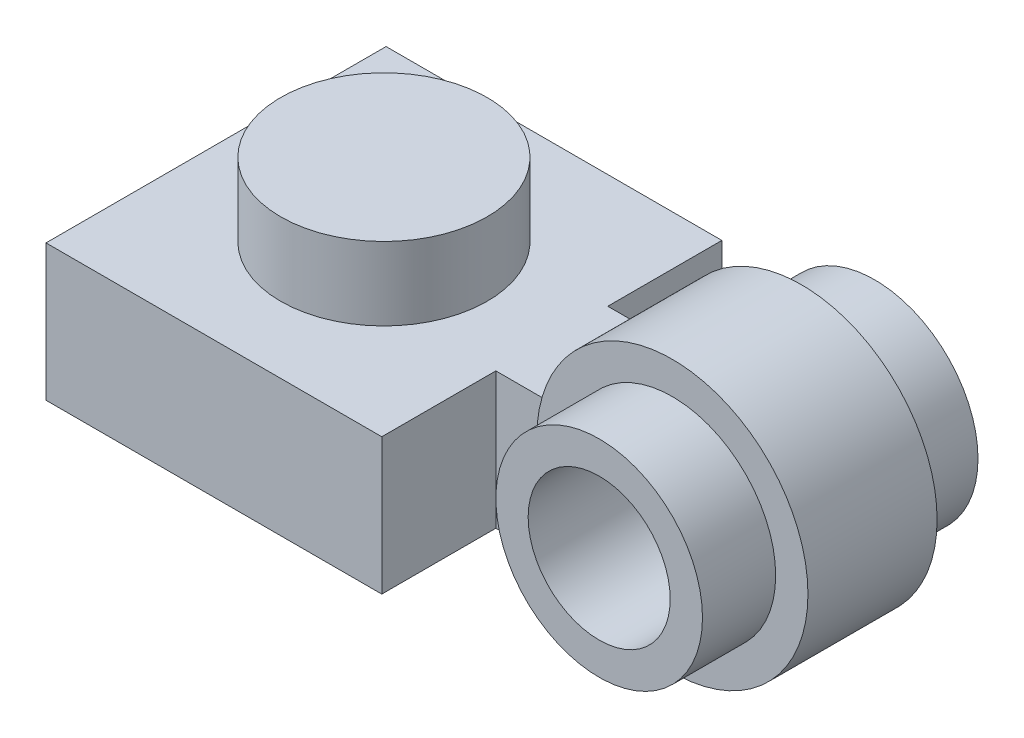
SolidWorks part; units mm, degrees
ref_plane "Front Plane" through (0, 0, 0) normal (0, 0, 1) x (1, 0, 0)
ref_plane "Top Plane" through (0, 0, 0) normal (0, 1, 0) x (1, 0, 0)
ref_plane "Right Plane" through (0, 0, 0) normal (1, 0, 0) x (0, 0, -1)
sketch "Sketch1" plane through (0, 0, 0) normal (0, 1, 0) x (1, 0, 0)
  line L1 (3.9, -3.95) -> (-3.9, -3.95)
  line L2 (3.9, -3.95) -> (3.9, 3.95)
  line L3 (3.9, 3.95) -> (-3.9, 3.95)
  line L4 (-3.9, -3.95) -> (-3.9, 3.95)
  line L5 (3.9, -3.95) -> (-3.9, 3.95) construction
  line L6 (3.9, 3.95) -> (-3.9, -3.95) construction
  point P0 (0, 0)
  dimension "D1" = 7.8
  dimension "D2" = 7.9
extrude "Extrude1" add sketch "Sketch1" along normal blind 3.166
sketch "Sketch2" plane through (0, 3.166, 0) normal (0, 1, 0) x (1, 0, 0)
  circle A0 centre (0, 0) radius 2.4
  dimension "D1" = 4.8
extrude "Extrude2" add sketch "Sketch2" along normal blind 1.7
sketch "Sketch3" plane through (0, 0, 0) normal (0, -1, 0) x (1, 0, 0)
  line L0 (-3.9, 3.95) -> (3.9, 3.95) construction
  line L1 (2.45, -2.5) -> (-2.45, -2.5)
  line L2 (2.45, -2.5) -> (2.45, 2.5)
  line L3 (2.45, 2.5) -> (-2.45, 2.5)
  line L4 (-2.45, -2.5) -> (-2.45, 2.5)
  line L5 (2.45, -2.5) -> (-2.45, 2.5) construction
  line L6 (2.45, 2.5) -> (-2.45, -2.5) construction
  line L7 (3.9, 3.95) -> (3.9, -3.95) construction
  point P0 (0, 0)
  dimension "D1" = 1.45
  dimension "D2" = 1.45
extrude "Extrude3" cut sketch "Sketch3" against normal blind 2.5
ref_plane " " through (3.9, 0, 0) normal (1, 0, 0) x (0, 0, -1)
sketch "Sketch5" plane through (3.9, 0, 0) normal (1, 0, 0) x (0, 0, -1)
  line L0 (-1.3, 3.166) -> (1.3, 3.166)
  line L1 (-3.95, 3.166) -> (3.95, 3.166) construction
  line L2 (1.3, 3.166) -> (1.3, 0)
  line L3 (-3.95, 0) -> (3.95, 0) construction
  line L4 (1.3, 0) -> (-1.3, 0)
  line L5 (-1.3, 0) -> (-1.3, 3.166)
  line L6 (0, 4.866) -> (0, 3.166) construction
  dimension "D1" = 2.6
  dimension "D2" = 1.3
extrude "Boss-Extrude2" add sketch "Sketch5" along normal blind 6.8
fillet "Fillet2" radius 1 2 edges at (10.7, 3.166, 0) (10.7, 0, 0)
sketch "Sketch7" plane through (0, 0, 0) normal (0, 0, 1) x (1, 0, 0)
  line L0 (3.9, -3.465) -> (3.9, 3.465) construction
  line L1 (-3.9, 0) -> (3.9, 0) construction
  circle A0 centre (8.2, 2.5) radius 3.15
  dimension "D1" = 6.3
  dimension "D2" = 4.3
  dimension "D3" = 2.5
extrude "Boss-Extrude5" add sketch "Sketch7" along normal mid plane 3
sketch "Sketch10" plane through (0, 0, 1.5) normal (0, 0, 1) x (1, 0, 0)
  circle A0 centre (8.2, 2.5) radius 2.4
  dimension "D1" = 4.8
extrude "Boss-Extrude6" add sketch "Sketch10" along normal blind 1.7
sketch "Sketch11" plane through (0, 0, -1.5) normal (0, 0, -1) x (-1, 0, 0)
  circle A0 centre (-8.2, 2.5) radius 2.4
  dimension "D1" = 4.8
extrude "Boss-Extrude7" add sketch "Sketch11" along normal blind 1.7
sketch "Sketch12" plane through (0, 0, -3.2) normal (0, 0, -1) x (-1, 0, 0)
  circle A0 centre (-8.2, 2.5) radius 1.65
  dimension "D1" = 3.3
extrude "Cut-Extrude2" cut sketch "Sketch12" against normal through all
